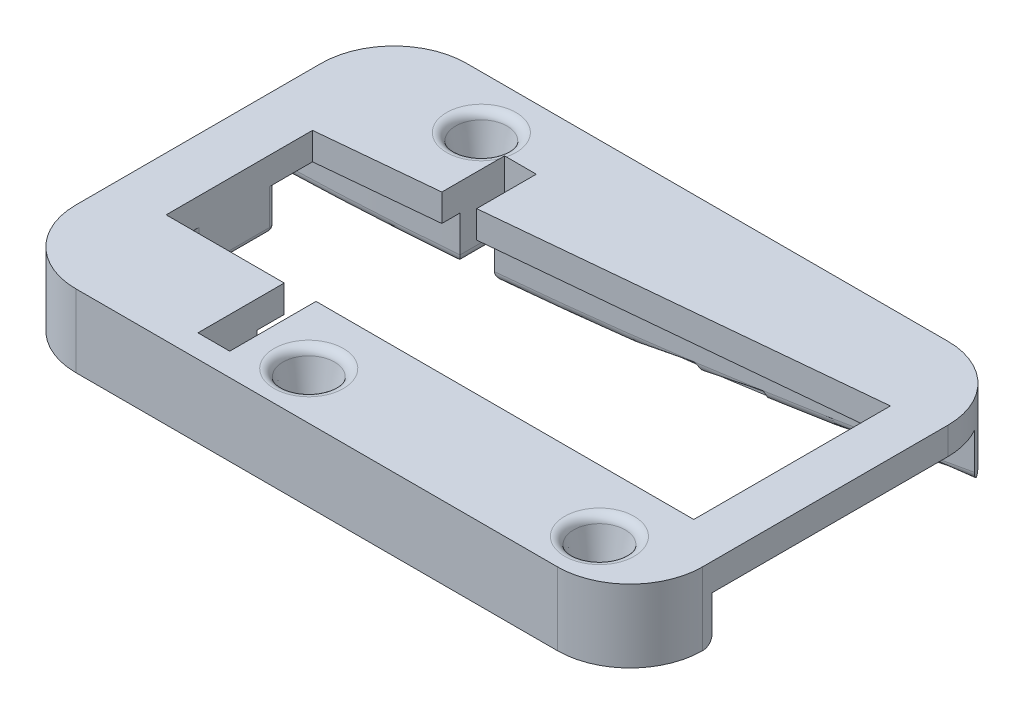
SolidWorks part; units mm, degrees
ref_plane "Přední rovina" through (0, 0, 0) normal (0, 0, 1) x (1, 0, 0)
ref_plane "Horní rovina" through (0, 0, 0) normal (0, 1, 0) x (1, 0, 0)
ref_plane "Pravá rovina" through (0, 0, 0) normal (1, 0, 0) x (0, 0, -1)
sketch "Skica3" plane through (0, 0, 0) normal (0, 1, 0) x (1, 0, 0)
  line L1 (13.6003, 0) -> (83.6003, 0)
  line L2 (13.6003, 0) -> (13.6003, 48)
  line L3 (13.6003, 48) -> (83.6003, 48)
  line L4 (83.6003, 0) -> (83.6003, 48)
  dimension "D1" = 48
  dimension "D2" = 70
extrude "Přidat vysunutím5" add sketch "Skica3" along normal blind 8
sketch "Skica4" plane through (0, 0, 0) normal (0, -1, 0) x (1, 0, 0)
  line L14 (14.0628, -24.7716) -> (35.2628, -24.7716) construction
  line L15 (35.2628, -4.9423) -> (35.2628, -44.5976) construction
  line L16 (37.0128, -14.0216) -> (37.0128, -7.5216)
  line L17 (37.0128, -7.5216) -> (33.5128, -7.5216)
  line L18 (37.0128, -14.0216) -> (143.3128, -14.0216)
  line L19 (129.5939, -35.0216) -> (143.3128, -35.0216)
  line L36 (33.5128, -36.3647) -> (33.5128, -41.2716)
  line L40 (145.8532, -39.8609) -> (139.7943, -60.2179)
  line L41 (143.3128, -35.0216) -> (143.3128, -14.0216)
  line L43 (13.8128, -35.2716) -> (13.8128, -14.0216)
  line L44 (104.8109, -49.8058) -> (139.7943, -60.2179)
  line L45 (145.8532, -39.8609) -> (129.5939, -35.0216)
  line L46 (33.5128, -7.5216) -> (33.5128, -14.0216)
  line L48 (33.5128, -41.2716) -> (37.0128, -41.2716)
  line L49 (37.0128, -41.2716) -> (37.0128, -36.6748)
  line L50 (33.5128, -14.0216) -> (13.8128, -14.0216)
  line L51 (33.5128, -36.3647) -> (33.5128, -41.2716)
  circle A12 centre (75.0128, -10.2216) radius 2.5
  circle A13 centre (35.2628, -24.7716) radius 0.5
  circle A14 centre (43.0128, -10.2216) radius 2.5
  circle A15 centre (30.0128, -42.2216) radius 2.5
  arc A16 (37.0128, -36.6748) -> (104.8109, -49.8058) centre (4.1127, -388.1383) cw
  arc A17 (13.8128, -35.2716) -> (33.5128, -36.3647) centre (4.1127, -388.1383) cw
  dimension "D6" = 5
  dimension "D7" = 17.45
  dimension "D2" = 5
  dimension "D3" = 5
  dimension "D11" = 353
  dimension "D4" = 32
  dimension "D5" = 14.55
  dimension "D8" = 5.25
  dimension "D9" = 7.75
  dimension "D10" = 3.5
  dimension "D12" = 10.75
  dimension "D13" = 129.5
  dimension "D14" = 3.5
  dimension "D15" = 10.75
extrude "Odebrat vysunutím3" cut sketch "Skica4" against normal blind 5 contours L48 L49 A16 L44 L40 L45 L19 L41 L18 L16 L17 L46 L50 L43 A17 L36
sketch "Skica6" plane through (0, 0, 0) normal (0, -1, 0) x (1, 0, 0)
  line L0 (37.0128, -14.0216) -> (37.0128, -7.5216) construction
  circle A0 centre (75.0128, -10.2216) radius 2
  circle A1 centre (43.0128, -10.2216) radius 2
  circle A2 centre (30.0128, -42.2216) radius 2
  dimension "D7" = 4
  dimension "D8" = 4
  dimension "D9" = 4
  dimension "D1" = 3.5
  dimension "D2" = 0.95
  dimension "D3" = 6
  dimension "D4" = 2.7
  dimension "D5" = 0
  dimension "D6" = 32
extrude "Odebrat vysunutím4" cut sketch "Skica6" against normal blind 10
sketch "Skica8" plane through (0, 8, 0) normal (0, 1, 0) x (1, 0, 0)
  line L1 (83.6003, 48) -> (14.6003, 48)
  line L2 (83.6003, 48) -> (83.6003, 5)
  line L3 (83.6003, 5) -> (14.6003, 5)
  line L4 (14.6003, 48) -> (14.6003, 5)
  dimension "D1" = 69
  dimension "D2" = 43
extrude "Odebrat vysunutím6" cut sketch "Skica8" against normal blind 10 flip side to cut
chamfer "Zkosení2" distance 5 distance2 1 3 edges at (30.0128, 8, -44.2216) (43.0128, 8, -12.2216) (75.0128, 8, -12.2216)
sketch "Skica10" plane through (0, 5, 0) normal (0, -1, 0) x (1, 0, 0)
  line L0 (33.5128, -36.3647) -> (33.5128, -14.0216) construction
  line L1 (18.0128, -20.0216) -> (20.5128, -20.0216)
  line L2 (18.0128, -20.0216) -> (18.0128, -29.0216)
  line L3 (18.0128, -29.0216) -> (20.5128, -29.0216)
  line L4 (20.5128, -20.0216) -> (20.5128, -29.0216)
  line L5 (18.0128, -20.0216) -> (20.5128, -29.0216) construction
  line L6 (18.0128, -29.0216) -> (20.5128, -20.0216) construction
  line L10 (33.5128, -14.0216) -> (14.6003, -14.0216) construction
  point P0 (19.2628, -24.5216)
  point P11 (19.2628, -20.0216)
  dimension "D1" = 13
  dimension "D2" = 2.5
  dimension "D3" = 9
  dimension "D4" = 6
extrude "Přidat vysunutím6" add sketch "Skica10" along normal blind 4.5
fillet "Zaoblit1" radius 1 10 edges at (24.0565, 0, -14.0216) (60.3065, 0, -14.0216) (60.4325, 0, -39.6601) (24.0637, 0, -35.7026) (33.5128, 0, -38.8182) (35.2628, 0, -41.2716) (37.0128, 0, -38.9732) (33.5128, 0, -10.7716) (35.2628, 0, -7.5216) (37.0128, 0, -10.7716)
fillet "Zaoblit2" radius 0.6 8 edges at (19.2628, 0.5, -29.0216) (18.0128, 0.5, -24.5216) (19.2628, 0.5, -20.0216) (20.5128, 0.5, -24.5216) (18.0128, 2.75, -20.0216) (20.5128, 2.75, -20.0216) (20.5128, 2.75, -29.0216) (18.0128, 2.75, -29.0216)
fillet "Zaoblit3" radius 1 3 edges at (75.0128, 8, -13.2216) (43.0128, 8, -13.2216) (30.0128, 8, -45.2216)
sketch "Skica11" plane through (0, 5, 0) normal (0, -1, 0) x (1, 0, 0)
  line L0 (78.6003, -17.0216) -> (37.0128, -17.0216)
  line L6 (78.6003, -17.0216) -> (78.6003, -38.6688)
  line L7 (78.6003, -38.6688) -> (37.0128, -34.7057)
  line L8 (37.0128, -14.0216) -> (83.6003, -14.0216) construction
  line L10 (83.6003, -14.0216) -> (83.6003, -44.2041) construction
  line L11 (37.0128, -7.5216) -> (37.0128, -17.0216)
  line L12 (37.0128, -7.5216) -> (33.5128, -7.5216)
  line L13 (33.5128, -7.5216) -> (33.5128, -17.0216)
  line L14 (33.5128, -17.0216) -> (20.5128, -17.0216)
  line L15 (33.5128, -41.2716) -> (33.5128, -34.3721)
  line L16 (33.5128, -41.2716) -> (37.0128, -41.2716)
  line L17 (37.0128, -41.2716) -> (37.0128, -34.7057)
  line L18 (33.5128, -34.3721) -> (20.5128, -33.1333)
  line L19 (20.5128, -17.0216) -> (20.5128, -33.1333)
  line L20 (20.5128, -28.4216) -> (20.5128, -20.6216) construction
  dimension "D1" = 3
  dimension "D2" = 0
  dimension "D3" = 5
extrude "Odebrat vysunutím7" cut sketch "Skica11" against normal up to surface (3 mm away)
fillet "Zaoblit5" radius 8 4 edges at (83.6003, 4, -48) (83.6003, 4, -5) (14.6003, 4, -5) (14.6003, 4, -48)
